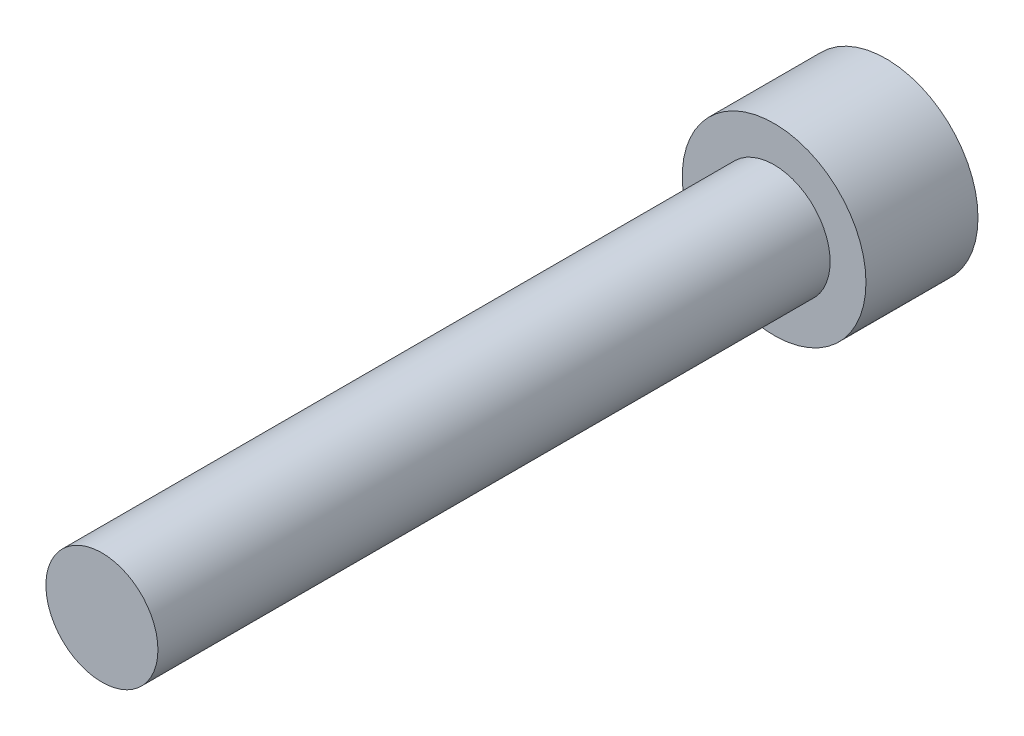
SolidWorks part; units mm, degrees
ref_plane "Front Plane" through (0, 0, 0) normal (0, 0, 1) x (1, 0, 0)
ref_plane "Top Plane" through (0, 0, 0) normal (0, 1, 0) x (1, 0, 0)
ref_plane "Right Plane" through (0, 0, 0) normal (1, 0, 0) x (0, 0, -1)
sketch "Sketch6" plane through (0, 0, 0) normal (1, 0, 0) x (0, 0, -1)
  line L0 (-19.05, 0) -> (22.525, 0) construction
  line L1 (2.8638, 0) -> (-2.8638, 0) construction
  line L2 (-19.05, 0) -> (-19.05, -1.5875)
  line L3 (-19.05, -1.5875) -> (0, -1.5875)
  line L4 (0, 2.8638) -> (0, -2.8638) construction
  line L5 (0, -1.5875) -> (0, -2.6035)
  line L6 (0, -2.6035) -> (3.175, -2.6035)
  line L7 (3.175, -2.6035) -> (3.175, 0)
  line L8 (3.175, 0) -> (-19.05, 0)
  dimension "L" = 19.05
  dimension "H" = 3.175
  dimension "A" = 5.207
  dimension "D" = 3.175
revolve "Revolve1" add sketch "Sketch6" angle 360 about L0
sketch "Sketch7" plane through (0, 0, -3.175) normal (0, 0, -1) x (-1, 0, 0)
  line L2 (-1.1811, 0.6819) -> (-1.1811, -0.6819)
  line L4 (-1.1811, -0.6819) -> (0, -1.3638)
  line L5 (0, -1.3638) -> (1.1811, -0.6819)
  line L6 (1.1811, -0.6819) -> (1.1811, 0.6819)
  line L7 (1.1811, 0.6819) -> (0, 1.3638)
  line L8 (0, 1.3638) -> (-1.1811, 0.6819)
  circle A0 centre (0, 0) radius 1.1811 construction
  dimension "J" = 2.3622
extrude "HEX" cut sketch "Sketch7" against normal blind 1.778
